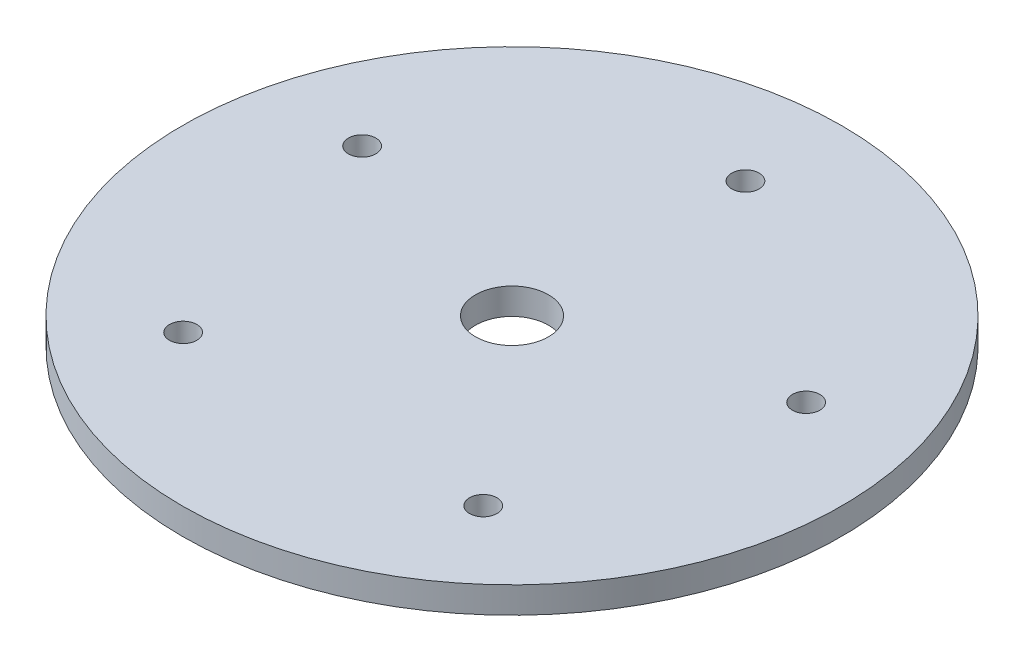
SolidWorks part; units mm, degrees
ref_plane "Front Plane" through (0, 0, 0) normal (0, 0, 1) x (1, 0, 0)
ref_plane "Top Plane" through (0, 0, 0) normal (0, 1, 0) x (1, 0, 0)
ref_plane "Right Plane" through (0, 0, 0) normal (1, 0, 0) x (0, 0, -1)
sketch "Sketch1" plane through (0, 0, 0) normal (0, 1, 0) x (1, 0, 0)
  circle A0 centre (0, 0) radius 26.9875 construction
  circle A1 centre (0, 0) radius 38.1
  circle A2 centre (0, 26.9875) radius 1.5875
  circle A3 centre (25.6666, 8.3396) radius 1.5875
  circle A4 centre (17.3472, -20.6736) radius 1.5875
  circle A5 centre (-17.3472, -20.6736) radius 1.5875
  circle A6 centre (-25.6666, 8.3396) radius 1.5875
  dimension "D1" = 3.175
  dimension "D2" = 53.975
  dimension "D3" = 76.2
  dimension "D4" = 72
  dimension "D5" = 68
  dimension "D6" = 80
  dimension "D7" = 68
  dimension "D8" = 72
extrude "Boss-Extrude1" add sketch "Sketch1" along normal blind 3.048
sketch "Sketch2" plane through (0, 3.048, 0) normal (0, 1, 0) x (1, 0, 0)
  circle A0 centre (0, 0) radius 4.2164
extrude "1/8 NPT hole" cut sketch "Sketch2" against normal through all both and the other way through all
